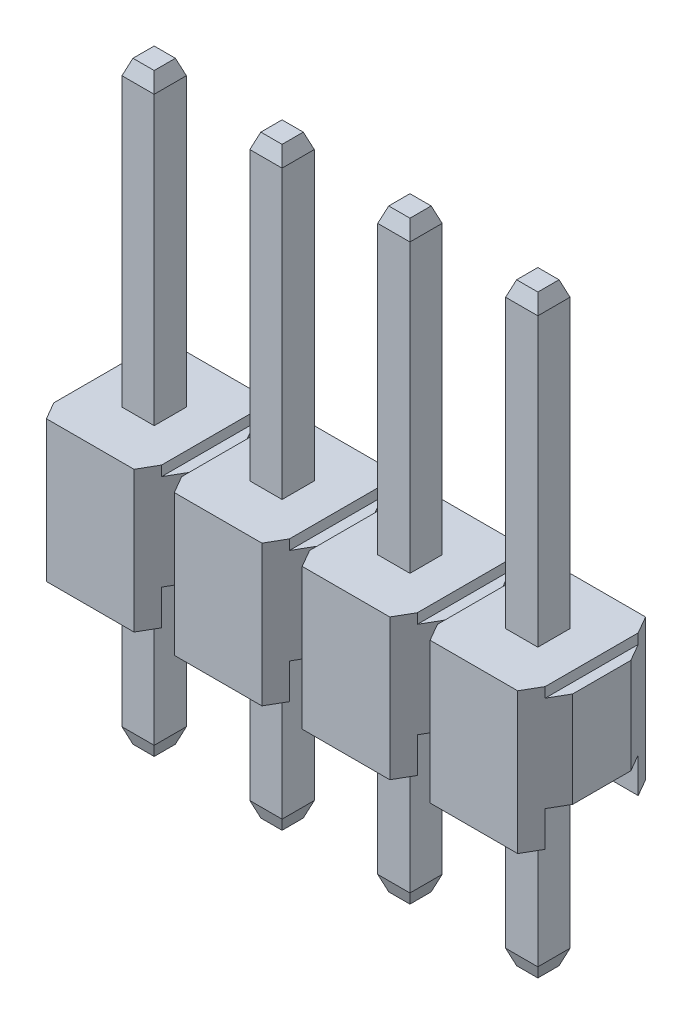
SolidWorks part; units mm, degrees
ref_plane "Front" through (0, 0, 0) normal (0, 0, 1) x (1, 0, 0)
ref_plane "Top" through (0, 0, 0) normal (0, 1, 0) x (1, 0, 0)
ref_plane "Right" through (0, 0, 0) normal (1, 0, 0) x (0, 0, -1)
sketch "Эскиз2" plane through (0, 0, 0) normal (0, 1, 0) x (1, 0, 0)
  line L0 (-1.27, 0.5772) -> (-0.87, 1.27)
  line L1 (-0.87, 1.27) -> (0.87, 1.27)
  line L2 (-1.27, 0.5772) -> (-1.27, -0.5772)
  line L3 (-0.87, -1.27) -> (0.87, -1.27)
  line L4 (1.27, 0.5772) -> (1.27, -0.5772)
  line L5 (0.87, 1.27) -> (1.27, 0.5772)
  line L6 (0.87, -1.27) -> (1.27, -0.5772)
  line L7 (-1.27, -0.5772) -> (-0.87, -1.27)
  line L8 (0, -1.27) -> (0, 1.27) construction
  dimension "D1" = 2.54
  dimension "D2" = 2.54
  dimension "D3" = 60
  dimension "D4" = 1.27
  dimension "D5" = 60
  dimension "D6" = 0.4
extrude "Вытянуть2" add sketch "Эскиз2" along normal blind 2.8
sketch "Эскиз3" plane through (0, 0, 0) normal (1, 0, 0) x (0, 0, -1)
  line L0 (-1.27, 0) -> (-0.5772, 0) construction
  line L1 (-0.9236, 0) -> (0.9236, 0)
  line L2 (-0.9236, 0) -> (-0.9236, 0.7)
  line L3 (-0.9236, 0.7) -> (0.9236, 0.7)
  line L4 (0.9236, 0) -> (0.9236, 0.7)
  line L5 (0.5772, 0) -> (1.27, 0) construction
  dimension "D1" = 0.7
extrude "Вырез-Вытянуть1" cut sketch "Эскиз3" against normal mid plane 2.54
sketch "Эскиз4" plane through (0, 0, 0) normal (0, 0, 1) x (1, 0, 0)
  line L1 (-1.27, 2.8) -> (-1.07, 2.8)
  line L2 (-1.27, 2.8) -> (-1.27, 2.6)
  line L3 (-1.27, 2.6) -> (-1.07, 2.6)
  line L4 (-1.07, 2.8) -> (-1.07, 2.6)
  line L5 (1.27, 2.8) -> (1.07, 2.8)
  line L6 (1.27, 2.8) -> (1.27, 2.6)
  line L7 (1.27, 2.6) -> (1.07, 2.6)
  line L8 (1.07, 2.8) -> (1.07, 2.6)
  dimension "D1" = 0.2
extrude "Вырез-Вытянуть2" cut sketch "Эскиз4" against normal through all and the other way through all
sketch "Эскиз1" plane through (0, 0, 0) normal (0, 1, 0) x (1, 0, 0)
  line L0 (-0.32, 0) -> (0.32, 0) construction
  line L1 (-0.32, 0.32) -> (0.32, 0.32)
  line L2 (-0.32, 0.32) -> (-0.32, -0.32)
  line L3 (-0.32, -0.32) -> (0.32, -0.32)
  line L4 (0.32, 0.32) -> (0.32, -0.32)
  dimension "D1" = 0.64
extrude "Вытянуть1" add sketch "Эскиз1" along normal blind 8.8 and the other way blind 3
chamfer "Фаска1" distance 0.3 angle 20 4 edges at (0, 8.8, -0.32) (0.32, 8.8, 0) (0, 8.8, 0.32) (-0.32, 8.8, 0)
chamfer "Фаска2" distance 0.11 angle 70 4 edges at (0, -3, 0.32) (0.32, -3, 0) (0, -3, -0.32) (-0.32, -3, 0)
pattern_linear "Линейный массив1" count 4 spacing 2.54 along (-1, 0, 0) of "Вытянуть2", "Вырез-Вытянуть1", "Вырез-Вытянуть2"
pattern_linear "Линейный массив2" count 100 spacing 2.54 along (-1, 0, 0) of "Вытянуть1", "Фаска1", "Фаска2"
